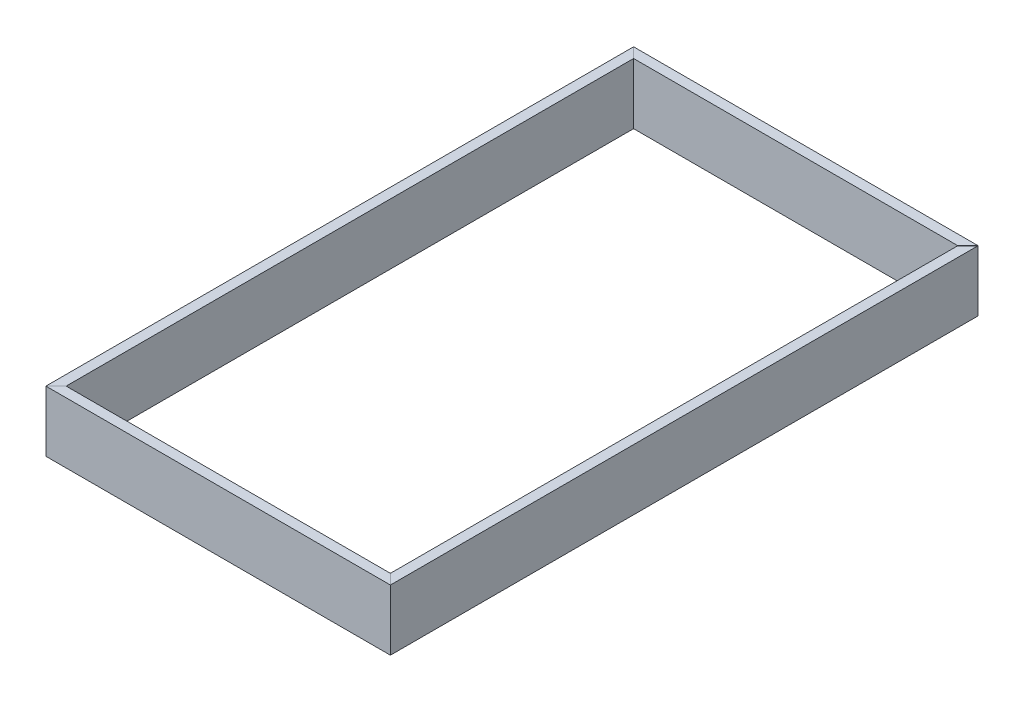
SolidWorks part; units mm, degrees
ref_plane "Front Plane" through (0, 0, 0) normal (0, 0, 1) x (1, 0, 0)
ref_plane "Top Plane" through (0, 0, 0) normal (0, 1, 0) x (1, 0, 0)
ref_plane "Right Plane" through (0, 0, 0) normal (1, 0, 0) x (0, 0, -1)
sketch "Sketch1" plane through (0, 0, 0) normal (0, 0, 1) x (1, 0, 0)
  line L0 (0, 0) -> (19.05, 0)
  line L1 (19.05, 0) -> (19.05, -19.05)
  line L2 (0, -3.175) -> (15.875, -3.175)
  line L3 (15.875, -3.175) -> (15.875, -19.05)
  line L4 (0, 0) -> (0, -3.175)
  line L5 (15.875, -19.05) -> (19.05, -19.05)
  line L6 (69.85, 0) -> (69.85, -19.05) construction
  line L7 (123.825, -19.05) -> (120.65, -19.05)
  line L8 (139.7, 0) -> (139.7, -3.175)
  line L9 (123.825, -3.175) -> (123.825, -19.05)
  line L10 (139.7, -3.175) -> (123.825, -3.175)
  line L11 (120.65, 0) -> (120.65, -19.05)
  line L12 (139.7, 0) -> (120.65, 0)
  dimension "D1" = 19.05
  dimension "D2" = 19.05
  dimension "D4" = 101.6
  dimension "D3" = 3.175
extrude "Boss-Extrude1" add sketch "Sketch1" along normal mid plane 177.8
sketch "Sketch2" plane through (0, 0, 0) normal (0, 1, 0) x (1, 0, 0)
  line L0 (139.7, -88.9) -> (139.7, 88.9) construction
  line L1 (0, 88.9) -> (139.7, 88.9)
  line L2 (0, 88.9) -> (0, 107.95)
  line L3 (0, 107.95) -> (139.7, 107.95)
  line L4 (139.7, 88.9) -> (139.7, 107.95)
  line L5 (0, -88.9) -> (139.7, -88.9)
  line L6 (0, -88.9) -> (0, -107.95)
  line L7 (0, -107.95) -> (139.7, -107.95)
  line L8 (139.7, -88.9) -> (139.7, -107.95)
  dimension "D1" = 19.05
  dimension "D2" = 19.05
extrude "Boss-Extrude2" add sketch "Sketch2" against normal up to surface (3.175 mm away)
sketch "Sketch3" plane through (0, -3.175, 0) normal (0, -1, 0) x (1, 0, 0)
  line L0 (123.825, 88.9) -> (123.825, -88.9) construction
  line L1 (15.875, 88.9) -> (123.825, 88.9)
  line L2 (15.875, 88.9) -> (15.875, 92.075)
  line L3 (15.875, 92.075) -> (123.825, 92.075)
  line L4 (123.825, 88.9) -> (123.825, 92.075)
  line L6 (15.875, -88.9) -> (123.825, -88.9)
  line L7 (15.875, -88.9) -> (15.875, -92.075)
  line L8 (15.875, -92.075) -> (123.825, -92.075)
  line L9 (123.825, -88.9) -> (123.825, -92.075)
  dimension "D1" = 3.175
  dimension "D2" = 3.175
extrude "Boss-Extrude3" add sketch "Sketch3" along normal up to surface (15.875 mm away)
sketch "Sketch4" plane through (0, 0, 0) normal (0, 1, 0) x (1, 0, 0)
  line L0 (69.85, 107.95) -> (69.85, -107.95) construction
  line L1 (139.7, 107.95) -> (0, 107.95) construction
  line L2 (0, -107.95) -> (139.7, -107.95) construction
  line L3 (0, 0) -> (139.7, 0) construction
  line L4 (0, -107.95) -> (0, 107.95) construction
  line L5 (139.7, -107.95) -> (139.7, 107.95) construction
  line L6 (0, 107.95) -> (19.05, 88.9) construction
  line L7 (19.05, 88.9) -> (24.04, 83.91) construction
  line L8 (-0.018, 107.932) -> (19.032, 88.882)
  line L9 (19.032, 88.882) -> (24.022, 83.892)
  line L10 (0.018, 107.968) -> (19.068, 88.918)
  line L11 (19.068, 88.918) -> (24.058, 83.928)
  line L12 (-0.018, 107.932) -> (0.018, 107.968)
  line L13 (24.022, 83.892) -> (24.058, 83.928)
  line L14 (120.65, 88.9) -> (115.66, 83.91) construction
  line L15 (139.7, 107.95) -> (120.65, 88.9) construction
  line L16 (115.678, 83.892) -> (115.642, 83.928)
  line L17 (139.718, 107.932) -> (139.682, 107.968)
  line L18 (120.632, 88.918) -> (115.642, 83.928)
  line L19 (139.682, 107.968) -> (120.632, 88.918)
  line L20 (120.668, 88.882) -> (115.678, 83.892)
  line L21 (139.718, 107.932) -> (120.668, 88.882)
  line L22 (139.7, -107.95) -> (120.65, -88.9) construction
  line L23 (120.65, -88.9) -> (115.66, -83.91) construction
  line L24 (19.05, -88.9) -> (24.04, -83.91) construction
  line L25 (0, -107.95) -> (19.05, -88.9) construction
  line L26 (139.718, -107.932) -> (120.668, -88.882)
  line L27 (120.668, -88.882) -> (115.678, -83.892)
  line L28 (139.682, -107.968) -> (120.632, -88.918)
  line L29 (120.632, -88.918) -> (115.642, -83.928)
  line L30 (139.718, -107.932) -> (139.682, -107.968)
  line L31 (115.678, -83.892) -> (115.642, -83.928)
  line L32 (24.022, -83.892) -> (24.058, -83.928)
  line L33 (-0.018, -107.932) -> (0.018, -107.968)
  line L34 (19.068, -88.918) -> (24.058, -83.928)
  line L35 (0.018, -107.968) -> (19.068, -88.918)
  line L36 (19.032, -88.882) -> (24.022, -83.892)
  line L37 (-0.018, -107.932) -> (19.032, -88.882)
  dimension "D1" = 0.0254
  dimension "D2" = 0.0254
extrude "Cut-Extrude1" cut sketch "Sketch4" against normal through all
sketch "Sketch5" plane through (0, -3.175, 0) normal (0, -1, 0) x (1, 0, 0)
  line L0 (15.875, 92.0391) -> (15.875, 92.075) construction
  line L1 (15.875, 92.075) -> (15.9109, 92.075) construction
  line L2 (123.7891, 92.075) -> (123.825, 92.075) construction
  line L3 (123.825, 92.075) -> (123.825, 92.0391) construction
  line L4 (123.825, -92.0391) -> (123.825, -92.075) construction
  line L5 (123.825, -92.075) -> (123.7891, -92.075) construction
  line L6 (15.9109, -92.075) -> (15.875, -92.075) construction
  line L7 (15.875, -92.075) -> (15.875, -92.0391) construction
  line L9 (15.875, -92.075) -> (123.825, -92.075)
  line L10 (15.875, -92.075) -> (15.875, 92.075)
  line L11 (15.875, 92.075) -> (123.825, 92.075)
  line L12 (123.825, -92.075) -> (123.825, 92.075)
  line L13 (-12.7452, 124.0512) -> (164.934, 124.0512)
  line L14 (-12.7452, 124.0512) -> (-12.7452, -127.661)
  line L15 (-12.7452, -127.661) -> (164.934, -127.661)
  line L16 (164.934, 124.0512) -> (164.934, -127.661)
extrude "Cut-Extrude2" cut sketch "Sketch5" against normal through all
